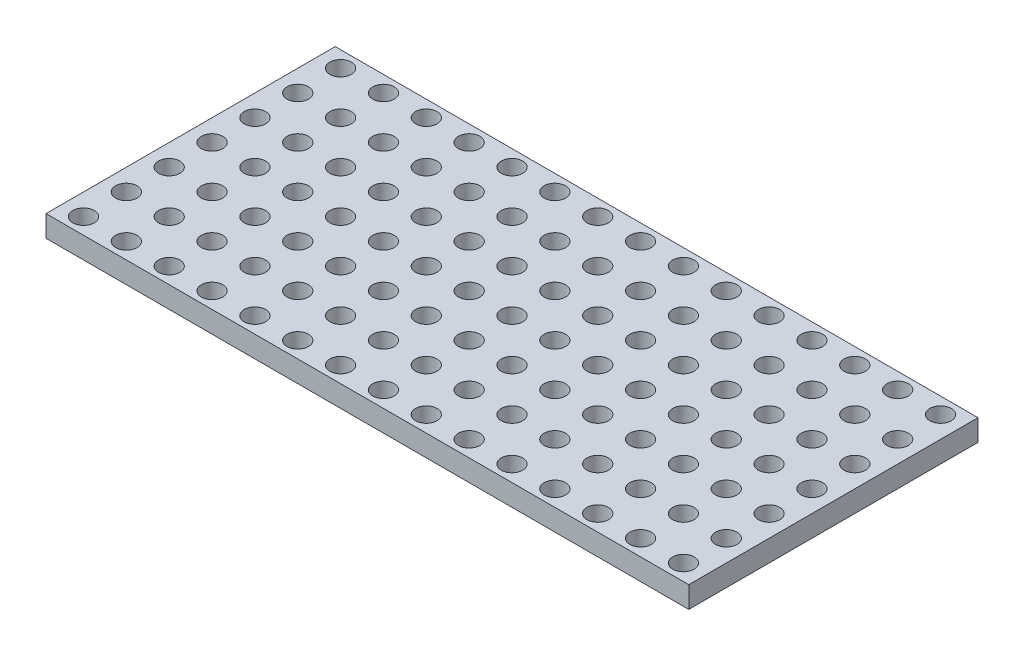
SolidWorks part; units mm, degrees
ref_plane "Front" through (0, 0, 0) normal (0, 0, 1) x (1, 0, 0)
ref_plane "Top" through (0, 0, 0) normal (0, 1, 0) x (1, 0, 0)
ref_plane "Right" through (0, 0, 0) normal (1, 0, 0) x (0, 0, -1)
sketch "Sketch1" plane through (0, 0, 0) normal (0, 1, 0) x (1, 0, 0)
  line L0 (0, 42.8625) -> (0, -42.8625) construction
  line L1 (-95.25, 42.8625) -> (95.25, 42.8625)
  line L2 (-95.25, 42.8625) -> (-95.25, -42.8625)
  line L3 (-95.25, -42.8625) -> (95.25, -42.8625)
  line L4 (95.25, 42.8625) -> (95.25, -42.8625)
  dimension "D1" = 190.5
  dimension "D2" = 85.725
extrude "Boss-Extrude1" add sketch "Sketch1" along normal blind 6.35
sketch "Sketch2" plane through (0, 6.35, 0) normal (0, 1, 0) x (1, 0, 0)
  circle A1 centre (0, 0) radius 3.175
  dimension "D1" = 6.35
extrude "Cut-Extrude1" cut sketch "Sketch2" against normal through all
other "Fill Pattern1" parameters "D10"=6.35, "D5"=0, "D6"=0, "D4"=12.7, "D9"=104, "D3"=0.7937, "D7"=9, "D8"=60
